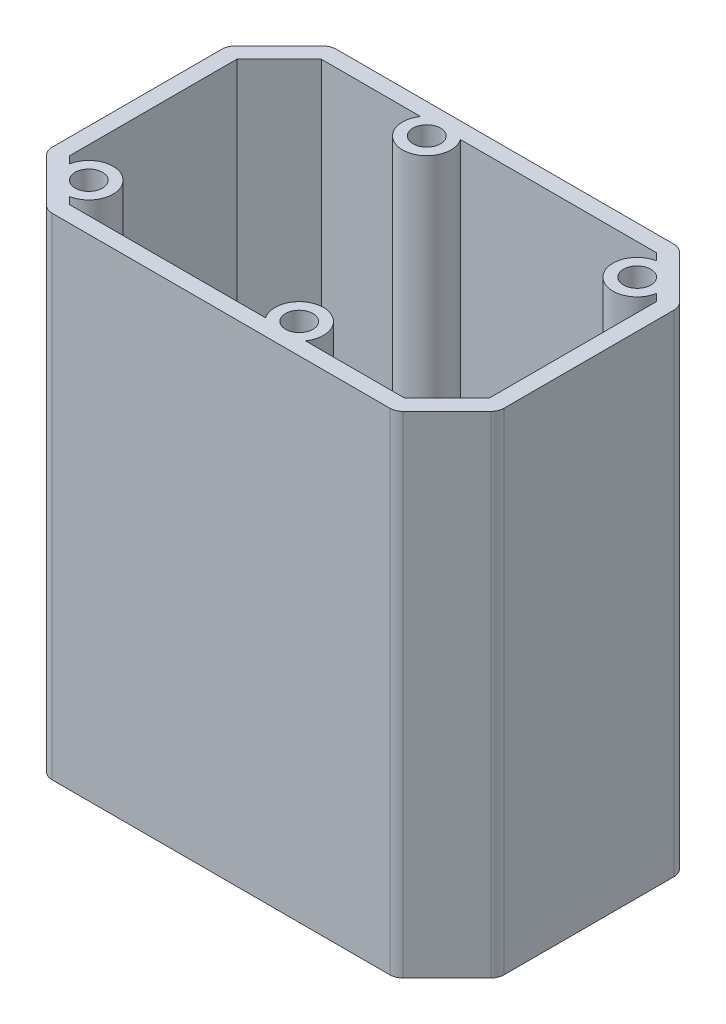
SolidWorks part; units mm, degrees
ref_plane "Front Plane" through (0, 0, 0) normal (0, 0, 1) x (1, 0, 0)
ref_plane "Top Plane" through (0, 0, 0) normal (0, 1, 0) x (1, 0, 0)
ref_plane "Right Plane" through (0, 0, 0) normal (1, 0, 0) x (0, 0, -1)
sketch "Sketch1" plane through (0, 0, 0) normal (0, 1, 0) x (1, 0, 0)
  line L0 (26.1716, 22) -> (-26.1716, 22)
  line L1 (-27.5858, 21.4142) -> (-34.4142, 14.5858)
  line L2 (-35, 13.1716) -> (-35, -13.1716)
  line L3 (-34.4142, -14.5858) -> (-27.5858, -21.4142)
  line L4 (-26.1716, -22) -> (26.1716, -22)
  line L5 (27.5858, -21.4142) -> (34.4142, -14.5858)
  line L6 (35, -13.1716) -> (35, 13.1716)
  line L7 (34.4142, 14.5858) -> (27.5858, 21.4142)
  line L8 (0, 22) -> (0, -22) construction
  line L9 (-32.5, 12.9645) -> (-32.5, -12.9645)
  line L10 (35, 0) -> (-35, 0) construction
  line L11 (-32.5, -12.9645) -> (-25.9645, -19.5)
  line L12 (-25.9645, -19.5) -> (25.9645, -19.5)
  line L13 (25.9645, -19.5) -> (32.5, -12.9645)
  line L14 (32.5, -12.9645) -> (32.5, 12.9645)
  line L15 (32.5, 12.9645) -> (25.9645, 19.5)
  line L16 (25.9645, 19.5) -> (-25.9645, 19.5)
  line L17 (-25.9645, 19.5) -> (-32.5, 12.9645)
  line L18 (-31, -18) -> (-29.2322, -16.2322) construction
  line L19 (31, 18) -> (29.2322, 16.2322) construction
  circle A3 centre (7.5, -17.375) radius 2.125
  circle A4 centre (27.7296, 14.7296) radius 2.125
  circle A5 centre (-7.5, 17.375) radius 2.125
  circle A6 centre (-27.7296, -14.7296) radius 2.125
  arc A9 (-26.1716, 22) -> (-27.5858, 21.4142) centre (-26.1716, 20) ccw
  arc A10 (-34.4142, 14.5858) -> (-35, 13.1716) centre (-33, 13.1716) ccw
  arc A11 (-35, -13.1716) -> (-34.4142, -14.5858) centre (-33, -13.1716) ccw
  arc A12 (-27.5858, -21.4142) -> (-26.1716, -22) centre (-26.1716, -20) ccw
  arc A13 (26.1716, -22) -> (27.5858, -21.4142) centre (26.1716, -20) ccw
  arc A14 (34.4142, -14.5858) -> (35, -13.1716) centre (33, -13.1716) ccw
  arc A15 (35, 13.1716) -> (34.4142, 14.5858) centre (33, 13.1716) ccw
  arc A16 (27.5858, 21.4142) -> (26.1716, 22) centre (26.1716, 20) ccw
  arc A21 (-32.5, -12.9645) -> (-32.5, -12.9645) centre (-32.5, -12.9645) ccw
  arc A22 (-25.9645, -19.5) -> (-25.9645, -19.5) centre (-25.9645, -19.5) ccw
  arc A23 (25.9645, -19.5) -> (25.9645, -19.5) centre (25.9645, -19.5) ccw
  arc A24 (32.5, -12.9645) -> (32.5, -12.9645) centre (32.5, -12.9645) ccw
  arc A25 (32.5, 12.9645) -> (32.5, 12.9645) centre (32.5, 12.9645) ccw
  arc A26 (25.9645, 19.5) -> (25.9645, 19.5) centre (25.9645, 19.5) ccw
  arc A27 (-25.9645, 19.5) -> (-25.9645, 19.5) centre (-25.9645, 19.5) ccw
  arc A28 (-32.5, 12.9645) -> (-32.5, 12.9645) centre (-32.5, 12.9645) ccw
  circle A29 centre (-7.5, 17.375) radius 3.75
  circle A30 centre (7.5, -17.375) radius 3.75
  circle A31 centre (27.7296, 14.7296) radius 3.75
  circle A32 centre (-27.7296, -14.7296) radius 3.75
  dimension "D2" = 7.5
  dimension "D4" = 4.25
  dimension "D1" = 44
  dimension "D5" = 70
  dimension "D6" = 27.5
  dimension "D7" = 27.5
  dimension "D3" = 2.5
extrude "Boss-Extrude2" add sketch "Sketch1" along normal blind 76 contours L7 A16 L0 A9 L1 A10 L2 A11 L3 A12 L4 A13 L5 A14 L6 A15 A32 L11 L9 L17 L16 A29 L15 A31 L14 L13 L12 A30 | L11 A32 A6 | L11 A32 | L12 A30 A3 | L12 A30 | L16 A29 | L16 A29 A5 | L15 A31 A4 | L15 A31
